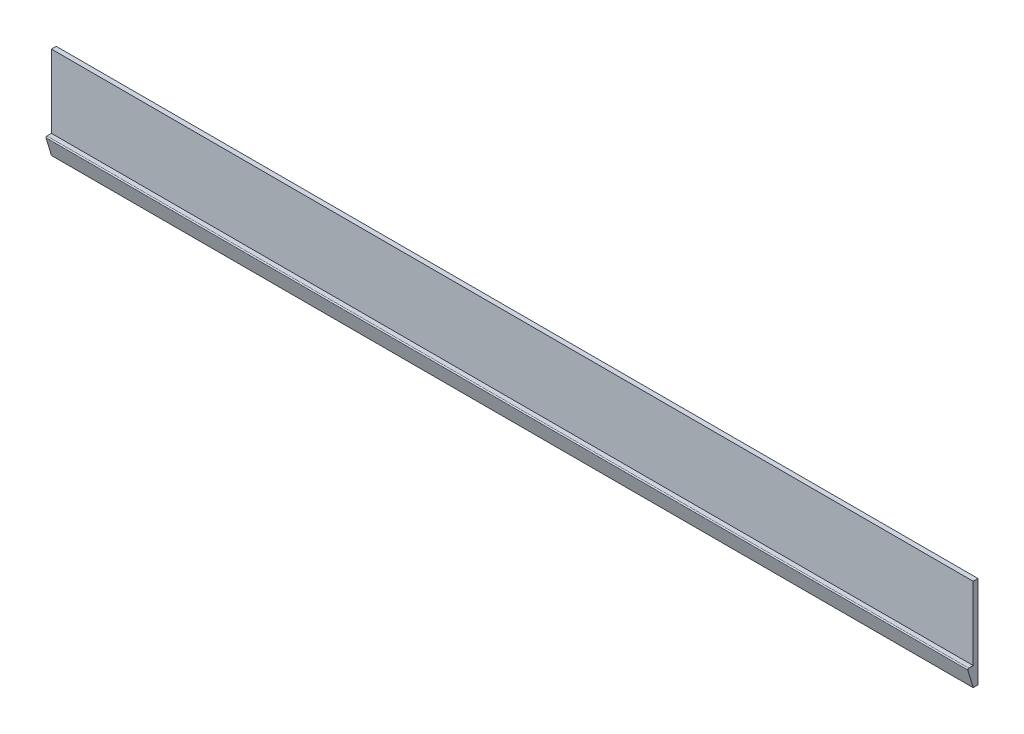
SolidWorks part; units mm, degrees
ref_plane "Front Plane" through (0, 0, 0) normal (0, 0, 1) x (1, 0, 0)
ref_plane "Top Plane" through (0, 0, 0) normal (0, 1, 0) x (1, 0, 0)
ref_plane "Right Plane" through (0, 0, 0) normal (1, 0, 0) x (0, 0, -1)
sketch "Sketch1" plane through (0, 0, 0) normal (1, 0, 0) x (0, 0, -1)
  line L0 (-1.25, -14) -> (-4.25, -14)
  line L1 (-1.25, 24) -> (1.25, 24)
  line L2 (-1.25, 24) -> (-1.25, -14)
  line L3 (-1.25, -24) -> (1.25, -24)
  line L4 (1.25, 24) -> (1.25, -24)
  line L5 (-1.25, 24) -> (1.25, -24) construction
  line L6 (-1.25, -24) -> (1.25, 24) construction
  line L7 (-4.25, -14) -> (-1.25, -24)
  point P0 (0, 0)
  dimension "D1" = 48
  dimension "D2" = 2.5
  dimension "D3" = 10
extrude "Boss-Extrude1" add sketch "Sketch1" along normal mid plane 480
fillet "Fillet1" radius 0.5 1 edges at (0, -14, 4.25)
